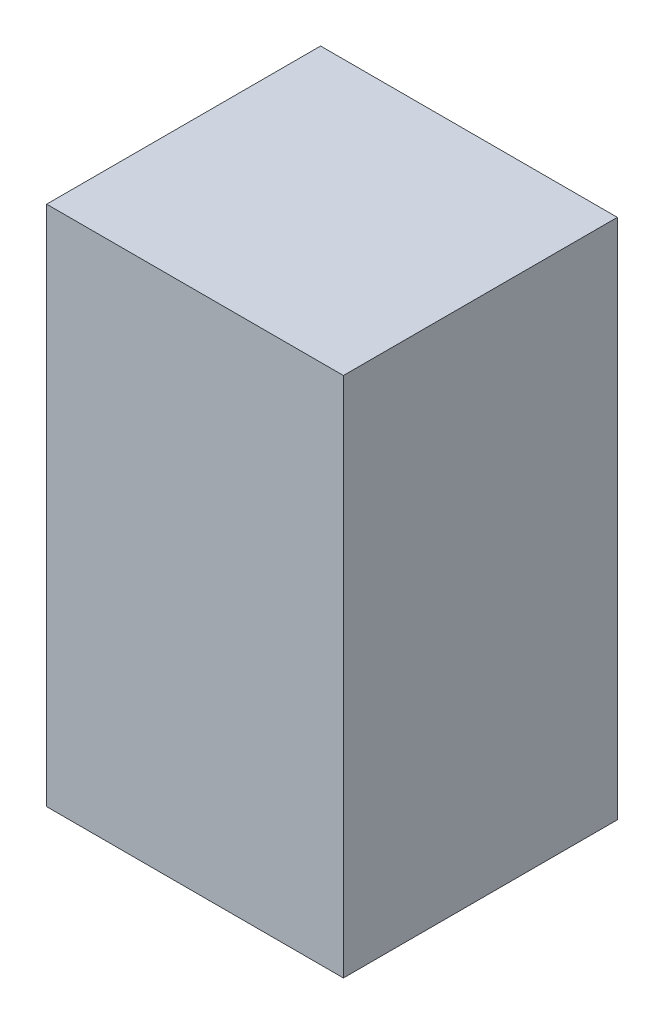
SolidWorks part; units mm, degrees
ref_plane "Front Plane" through (0, 0, 0) normal (0, 0, 1) x (1, 0, 0)
ref_plane "Top Plane" through (0, 0, 0) normal (0, 1, 0) x (1, 0, 0)
ref_plane "Right Plane" through (0, 0, 0) normal (1, 0, 0) x (0, 0, -1)
sketch "Sketch1" plane through (0, 0, 0) normal (0, 1, 0) x (1, 0, 0)
  line L1 (-9.525, 10.668) -> (13.589, 10.668)
  line L2 (-9.525, 10.668) -> (-9.525, -10.668)
  line L3 (-9.525, -10.668) -> (13.589, -10.668)
  line L4 (13.589, 10.668) -> (13.589, -10.668)
  dimension "D1" = 21.336
  dimension "D2" = 10.668
  dimension "D3" = 23.114
  dimension "D4" = 9.525
extrude "Extrude1" add sketch "Sketch1" along normal blind 40.64
